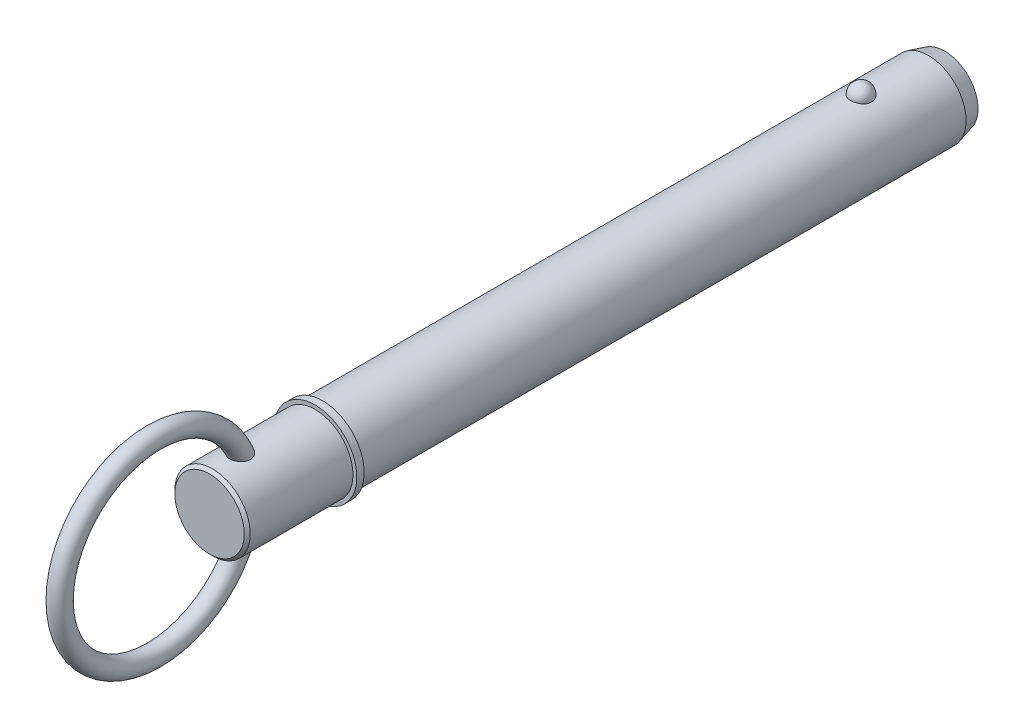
SolidWorks part; units mm, degrees
ref_plane "Front Plane" through (0, 0, 0) normal (0, 0, 1) x (1, 0, 0)
ref_plane "Top Plane" through (0, 0, 0) normal (0, 1, 0) x (1, 0, 0)
ref_plane "Right Plane" through (0, 0, 0) normal (1, 0, 0) x (0, 0, -1)
sketch "Sketch2" plane through (0, 0, 0) normal (0, 0, 1) x (1, 0, 0)
  circle A0 centre (0, 0) radius 12.7
  point P3 (0, 12.7)
  dimension "D1" = 25.4
extrude "Boss-Extrude1" add sketch "Sketch2" along normal blind 177.8
sketch "Sketch3" plane through (0, 0, 0) normal (0, 0, -1) x (-1, 0, 0)
  circle A0 centre (0, 0) radius 12.7
  dimension "D1" = 25.4
extrude "Boss-Extrude2" add sketch "Sketch3" along normal blind 31.75
chamfer "Chamfer1" distance 5.5 angle 15 1 edges at (-12.7, 0, -31.75)
sketch "Sketch18" plane through (0, 0, 0) normal (1, 0, 0) x (0, 0, -1)
  line L0 (26.25, 12.7) -> (-177.8, 12.7) construction
  line L1 (3.56, 16.26) -> (3.56, 9.14)
  line L2 (-177.8, -12.7) -> (26.25, -12.7) construction
  arc A0 (3.56, 16.26) -> (3.56, 9.14) centre (3.56, 12.7) ccw
  point P4 (0, 12.7)
  dimension "D1" = 28.96
revolve "Revolve1" add sketch "Sketch18" angle 360 about L1
sketch "Sketch19" plane through (0, 0, 0) normal (1, 0, 0) x (0, 0, -1)
  line L0 (-33.7288, 0) -> (-46.4542, 0) construction
sketch "Sketch20" plane through (0, 0, 0) normal (1, 0, 0) x (0, 0, -1)
  line L0 (-177.8, 0) -> (-177.8, 14)
  line L1 (-177.8, 12.7) -> (-177.8, -12.7) construction
  line L2 (-177.8, 14) -> (-180.3, 14)
  line L3 (-180.3, 14) -> (-180.3, 0)
  line L4 (-33.7288, 0) -> (-46.4542, 0) construction
  line L5 (-180.3, 0) -> (-177.8, 0)
  dimension "D1" = 14
  dimension "D2" = 2.5
revolve "Revolve2" add sketch "Sketch20" angle 360 about L0
sketch "Sketch21" plane through (0, 0, 177.8) normal (0, 0, -1) x (-1, 0, 0)
  circle A0 centre (0, 0) radius 12.7
  dimension "D1" = 25.4
extrude "Boss-Extrude3" add sketch "Sketch21" against normal blind 38.1
chamfer "Chamfer2" distance 1 angle 45 1 edges at (-12.7, 0, 215.9)
sketch "Sketch23" plane through (0, 0, 0) normal (1, 0, 0) x (0, 0, -1)
  line L0 (-215.9, 11.7) -> (-215.9, -11.7) construction
  circle A0 centre (-234.65, 0) radius 31.75
  point P2 (-202.9, 0)
  dimension "D1" = 63.5
  dimension "D2" = 13
sketch "Sketch24" plane through (0, 0, 0) normal (0, 1, 0) x (1, 0, 0)
  circle A0 centre (0, -202.9) radius 3.25
  dimension "D1" = 6.5
sweep "Sweep1" add profiles "Sketch24" path "Sketch23"
